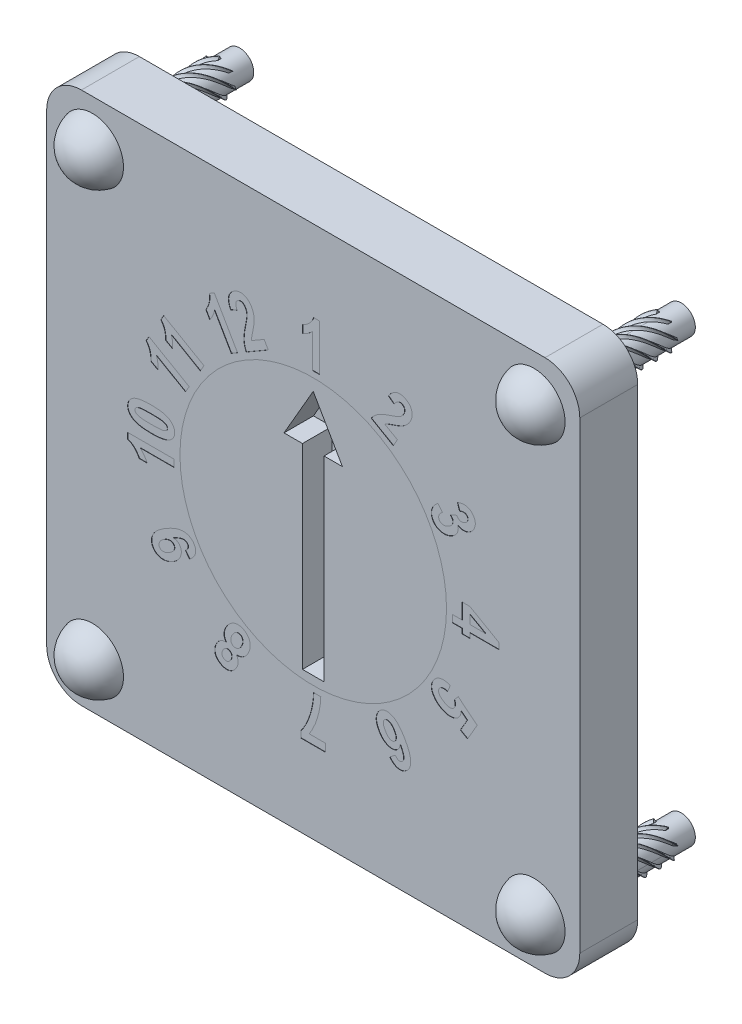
SolidWorks part; units mm, degrees
ref_plane "Front Plane" through (0, 0, 0) normal (0, 0, 1) x (1, 0, 0)
ref_plane "Top Plane" through (0, 0, 0) normal (0, 1, 0) x (1, 0, 0)
ref_plane "Right Plane" through (0, 0, 0) normal (1, 0, 0) x (0, 0, -1)
sketch "Sketch1" plane through (0, 0, 0) normal (0, 0, 1) x (1, 0, 0)
  line L1 (-20, 23) -> (20, 23)
  line L2 (-23, 20) -> (-23, -20)
  line L3 (-20, -23) -> (20, -23)
  line L4 (23, 20) -> (23, -20)
  line L5 (-23, 23) -> (23, -23) construction
  line L6 (-23, -23) -> (23, 23) construction
  arc A0 (20, 23) -> (23, 20) centre (20, 20) cw
  arc A1 (-23, -20) -> (-20, -23) centre (-20, -20) ccw
  arc A2 (-20, 23) -> (-23, 20) centre (-20, 20) ccw
  arc A3 (20, -23) -> (23, -20) centre (20, -20) ccw
  point P0 (0, 0)
  dimension "D1" = 3
  dimension "D2" = 46
  dimension "D3" = 46
extrude "Boss-Extrude1" add sketch "Sketch1" along normal blind 5
sketch "Sketch5" plane through (0, 0, 5) normal (0, 0, 1) x (1, 0, 0)
  line L0 (-19.5, 19.5) -> (-19.05, 19.05) construction
  line L1 (-18.2626, 20.7374) -> (-17.8126, 20.2874)
  line L2 (-20.7374, 18.2626) -> (-20.2874, 17.8126)
  line L3 (0, 20.2802) -> (0, 0) construction
  line L4 (0, 0) -> (-26.2232, 0) construction
  line L5 (19.5, 19.5) -> (19.05, 19.05) construction
  line L6 (18.2626, 20.7374) -> (17.8126, 20.2874)
  line L7 (20.7374, 18.2626) -> (20.2874, 17.8126)
  line L8 (19.5, -19.5) -> (19.05, -19.05) construction
  line L9 (18.2626, -20.7374) -> (17.8126, -20.2874)
  line L10 (20.7374, -18.2626) -> (20.2874, -17.8126)
  line L11 (-19.5, -19.5) -> (-19.05, -19.05) construction
  line L12 (-18.2626, -20.7374) -> (-17.8126, -20.2874)
  line L13 (-20.7374, -18.2626) -> (-20.2874, -17.8126)
  arc A0 (-18.2626, 20.7374) -> (-20.7374, 18.2626) centre (-19.5, 19.5) ccw
  arc A1 (-20.2874, 17.8126) -> (-17.8126, 20.2874) centre (-19.05, 19.05) ccw
  arc A2 (18.2626, 20.7374) -> (20.7374, 18.2626) centre (19.5, 19.5) cw
  arc A3 (20.2874, 17.8126) -> (17.8126, 20.2874) centre (19.05, 19.05) cw
  arc A4 (18.2626, -20.7374) -> (20.7374, -18.2626) centre (19.5, -19.5) ccw
  arc A5 (20.2874, -17.8126) -> (17.8126, -20.2874) centre (19.05, -19.05) ccw
  arc A6 (-18.2626, -20.7374) -> (-20.7374, -18.2626) centre (-19.5, -19.5) cw
  arc A7 (-20.2874, -17.8126) -> (-17.8126, -20.2874) centre (-19.05, -19.05) cw
  point P3 (-19.275, 19.275)
  point P14 (19.275, 19.275)
  point P21 (19.275, -19.275)
  point P28 (-19.275, -19.275)
  dimension "D1" = 1.75
  dimension "D2" = 38.1
  dimension "D3" = 38.1
  dimension "D4" = 39
  dimension "D5" = 39
extrude "Slots" cut sketch "Sketch5" against normal through all
sketch "Sketch13" plane through (0, 0, 5) normal (0, 0, 1) x (1, 0, 0)
  circle A0 centre (0, 0) radius 11.5
  dimension "D1" = 23
extrude "Cut-Extrude3" cut sketch "Sketch13" against normal through all
sketch "Sketch16" plane through (0, 0, 5) normal (0, 0, 1) x (1, 0, 0)
  line L0 (0, 0) -> (0, 12.009) construction
  line L1 (-2.4052, 12.009) -> (2.4052, 12.009) construction
  line L2 (0, 0) -> (6.0045, 10.4001) construction
  line L3 (3.9215, 11.6027) -> (8.0875, 9.1975) construction
  line L4 (0, 0) -> (10.4001, 6.0045) construction
  line L5 (9.1975, 8.0875) -> (11.6027, 3.9215) construction
  line L6 (0, 0) -> (12.009, 0) construction
  line L7 (12.009, 2.4052) -> (12.009, -2.4052) construction
  line L8 (0, 0) -> (10.4001, -6.0045) construction
  line L9 (11.6027, -3.9215) -> (9.1975, -8.0875) construction
  line L10 (0, 0) -> (6.0045, -10.4001) construction
  line L11 (8.0875, -9.1975) -> (3.9215, -11.6027) construction
  line L12 (0, 0) -> (0, -12.009) construction
  line L13 (2.4052, -12.009) -> (-2.4052, -12.009) construction
  line L14 (0, 0) -> (-6.0045, -10.4001) construction
  line L15 (-3.9215, -11.6027) -> (-8.0875, -9.1975) construction
  line L16 (0, 0) -> (-10.4001, -6.0045) construction
  line L17 (-9.1975, -8.0875) -> (-11.6027, -3.9215) construction
  line L18 (0, 0) -> (-12.009, 0) construction
  line L19 (-12.009, -2.4052) -> (-12.009, 2.4052) construction
  line L20 (0, 0) -> (-10.4001, 6.0045) construction
  line L21 (-11.6027, 3.9215) -> (-9.1975, 8.0875) construction
  line L22 (0, 0) -> (-6.0045, 10.4001) construction
  line L23 (-8.0875, 9.1975) -> (-3.9215, 11.6027) construction
  text T0 "1" font "Arial Narrow" height 4
  text T1 "2" font "Arial Narrow" height 4
  text T2 "3" font "Arial Narrow" height 4
  text T3 "4" font "Arial Narrow" height 4
  text T4 "5"
  text T5 "6"
  text T6 "7"
  text T7 "8"
  text T8 "9"
  text T9 "10"
  text T10 "11"
  text T11 "12"
  point P41 (0, 0)
  dimension "D1" = 12
extrude "MONTHS" cut sketch "Sketch16" against normal blind 0.0254
imported_body "Imported1"
move or copy body "Body-Move/Copy2" bodies to move or copy 121 placed by mates yes parameters "D1"=0, "D2"=0, "D3"=0
imported_body "Imported1_#4_.500_U-Drive Screw"
move or copy body "Body-Move/Copy4" bodies to move or copy 124 placed by mates yes parameters "D1"=0, "D2"=0, "D3"=0
pattern_circular "CirPattern2" count 4 over 360 about axis through (0, 0, 5) along (0, 0, 1)
